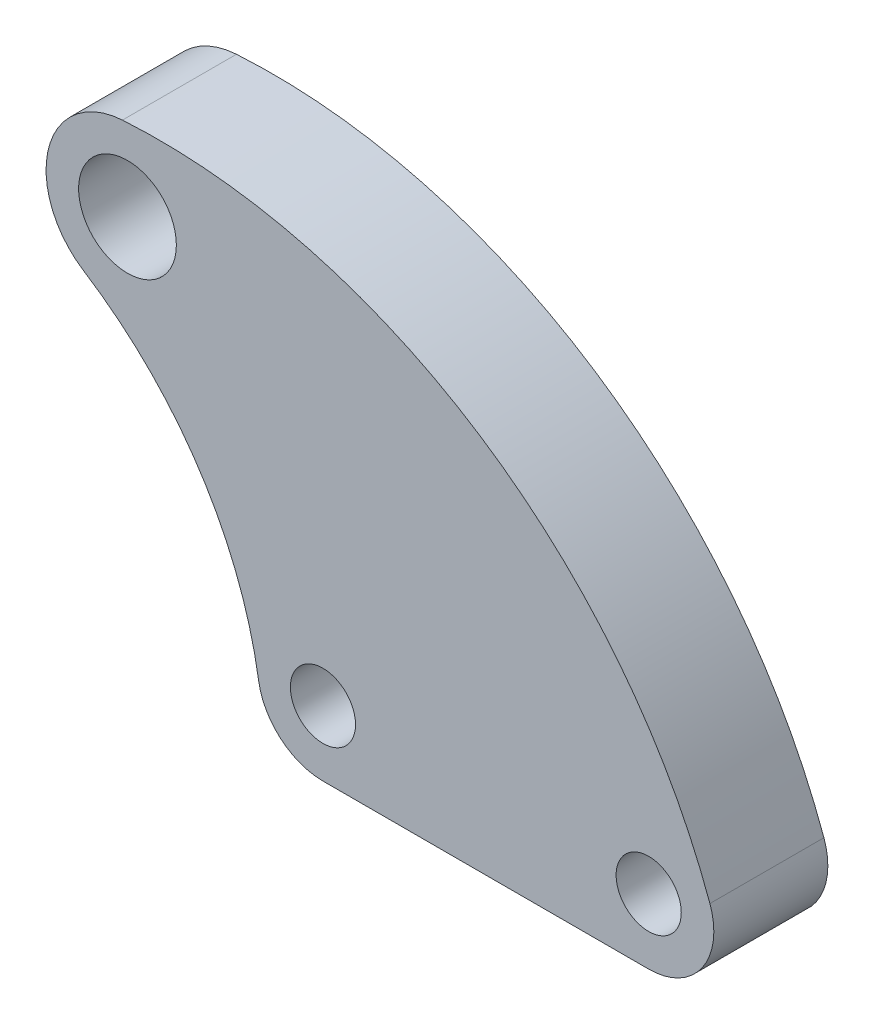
SolidWorks part; units mm, degrees
ref_plane "Front Plane" through (0, 0, 0) normal (0, 0, 1) x (1, 0, 0)
ref_plane "Top Plane" through (0, 0, 0) normal (0, 1, 0) x (1, 0, 0)
ref_plane "Right Plane" through (0, 0, 0) normal (1, 0, 0) x (0, 0, -1)
sketch "Sketch1" plane through (0, 0, 0) normal (0, 0, 1) x (1, 0, 0)
  line L0 (0, -20) -> (100, -20)
  circle A0 centre (0, 0) radius 10
  arc A1 (-19.7498, -3.1535) -> (0, -20) centre (0, 0) ccw
  circle A2 centre (100, 0) radius 10
  arc A3 (100, -20) -> (118.7949, 6.8375) centre (100, 0) ccw
  circle A4 centre (-60, 100) radius 15
  arc A5 (-61.555, 124.9516) -> (-73.4912, 78.9527) centre (-60, 100) ccw
  arc A6 (-61.555, 124.9516) -> (118.7949, 6.8375) centre (-50.3593, -54.6999) cw
  arc A7 (-73.4912, 78.9527) -> (-19.7498, -3.1535) centre (-138.2488, -22.0743) cw
  dimension "D1" = 20
  dimension "D2" = 20
  dimension "D4" = 30
  dimension "D5" = 25
  dimension "D8" = 180
  dimension "D9" = 120
  dimension "D3" = 100
  dimension "D6" = 100
  dimension "D7" = 60
extrude "Boss-Extrude1" add sketch "Sketch1" along normal mid plane 35
